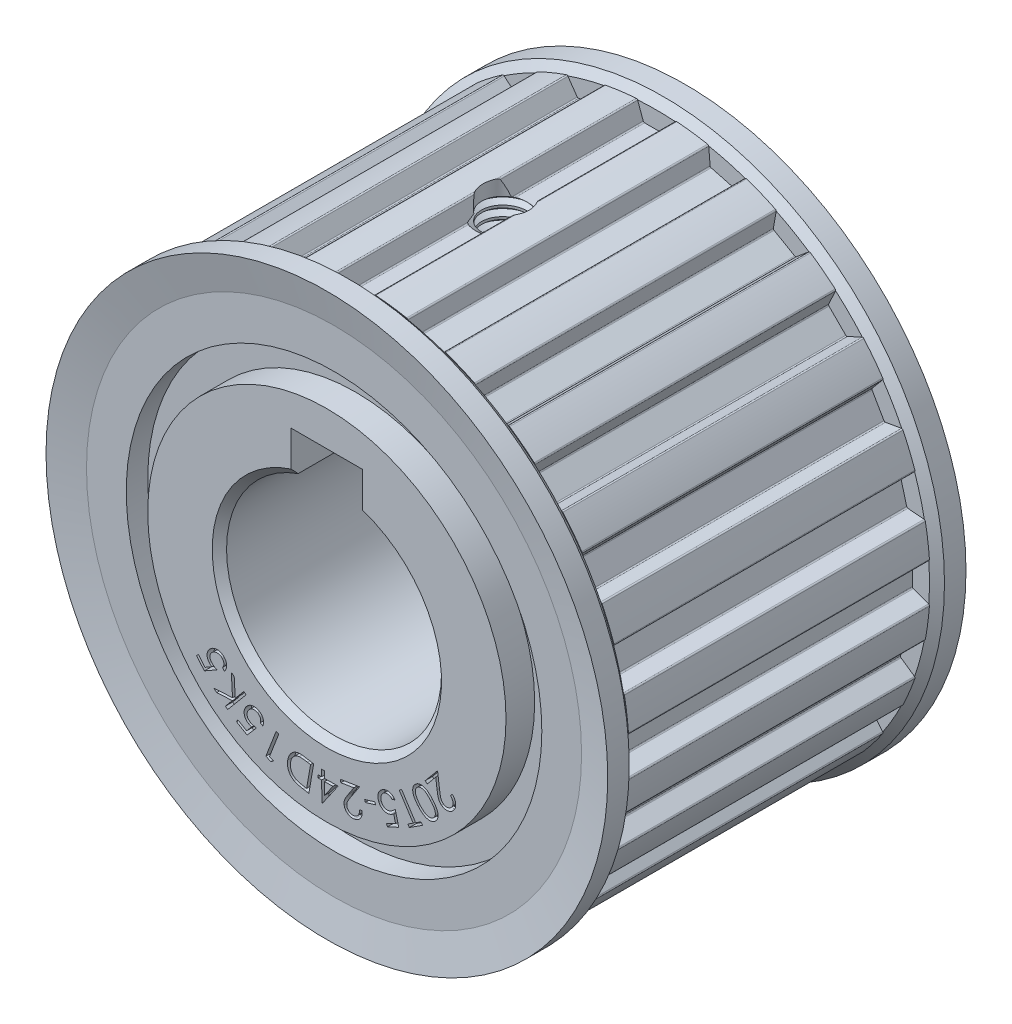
SolidWorks part; units mm, degrees
ref_plane "Front" through (0, 0, 0) normal (0, 0, 1) x (1, 0, 0)
ref_plane "Top" through (0, 0, 0) normal (0, 1, 0) x (1, 0, 0)
ref_plane "Right" through (0, 0, 0) normal (1, 0, 0) x (0, 0, -1)
sketch "Sketch2" plane through (0, 0, 0) normal (1, 0, 0) x (0, 0, -1)
  line L0 (0, 7.5) -> (0, 12.5)
  line L1 (0, 12.5) -> (2, 12.5)
  line L2 (25, 12.5) -> (25, 7.5)
  line L5 (25, 7.5) -> (0, 7.5)
  line L6 (2, 12.5) -> (2, 19.1)
  line L7 (2, 19.1) -> (23, 19.1)
  line L8 (23, 19.1) -> (23, 12.5)
  line L9 (23, 12.5) -> (25, 12.5)
  line L10 (0, 0) -> (27, 0) construction
  dimension "D2" = 19.1
  dimension "D3" = 7.5
  dimension "D4" = 25
  dimension "D6" = 2
  dimension "D7" = 2
  dimension "D8" = 12.5
revolve "Revolve1" add sketch "Sketch2" angle 360 about L10
chamfer "Chamfer1" distance 0.5 angle 45 2 edges at (7.5, 0, 0) (7.5, 0, -25)
sketch "Sketch3" plane through (0, 0, -2) normal (0, 0, 1) x (1, 0, 0)
  line L0 (0, 20.0532) -> (0, 17.8532) construction
  line L1 (0.9, 17.8532) -> (-0.9, 17.8532)
  line L2 (-0.9, 17.8532) -> (-1.3368, 19.0532)
  line L3 (0.9, 17.8532) -> (1.3368, 19.0532)
  line L5 (-1.3368, 19.0532) -> (-1.3368, 20.0532)
  line L6 (-1.3368, 20.0532) -> (1.3368, 20.0532)
  line L7 (1.3368, 20.0532) -> (1.3368, 19.0532)
  circle A0 centre (0, 0) radius 19.1 construction
  point P6 (0, 17.8532)
  dimension "D1" = 2.2
  dimension "D2" = 1.2
  dimension "D3" = 40
  dimension "D4" = 1.8
extrude "Cut-Extrude1" cut sketch "Sketch3" against normal up to next
fillet "Fillet1" radius 0.1 4 edges at (1.3368, 19.0532, -12.5) (0.9, 17.8532, -12.5) (-0.9, 17.8532, -12.5) (-1.3368, 19.0532, -12.5)
pattern_circular "CirPattern2" count 24 over 360 about axis through (0, 0, 0) along (0, 0, 1) of "Fillet1", "Cut-Extrude1"
sketch "Sketch4" plane through (0, 0, 0) normal (1, 0, 0) x (0, 0, -1)
  line L0 (2, 14.5) -> (2, 19.0477)
  line L1 (2, 12.5) -> (2, -12.5) construction
  line L2 (2, 15.9803) -> (2, 17.0945) construction
  line L3 (2, 19.0477) -> (1.5, 19.6)
  line L4 (1.5, 19.6) -> (0, 19.6)
  line L5 (0, 19.6) -> (0.5, 17.2739)
  line L6 (0.5, 17.2739) -> (0.5, 14.5)
  line L7 (0.5, 14.5) -> (2, 14.5)
  line L8 (2, 19.0477) -> (23, 19.0477) construction
  line L9 (0, 0) -> (27, 0) construction
  dimension "D1" = 0
  dimension "D2" = 5.1
  dimension "D3" = 14.5
  dimension "D4" = 0.5
  dimension "D5" = 0.5
revolve "Revolve2" add sketch "Sketch4" angle 360 about L9
ref_plane "Plane1" through (0, 0, -12.5) normal (0, 0, 1) x (1, 0, 0)
mirror "Mirror1" about plane through (0, 0, -12.5) normal (0, 0, 1) of "Revolve2"
sketch "Sketch5" plane through (0, 0, 0) normal (0, 0, 1) x (1, 0, 0)
  arc A0 (-8.3229, -4.5804) -> (8.3543, -4.5228) centre (0, 0) ccw construction
  text T0 "20T5-24D15K5" font "Century Gothic" height 2
extrude "Cut-Extrude2" cut sketch "Sketch5" against normal blind 0.5
ref_plane "Plane2" through (0, 18.9822, 0) normal (0, 1, 0) x (1, 0, 0)
sketch "Sketch6" plane through (0, 18.9822, 0) normal (0, 1, 0) x (1, 0, 0)
  line L0 (-1.3207, 23) -> (1.3207, 23) construction
  circle A0 centre (0, 12.5) radius 1.6
  dimension "D1" = 10.5
extrude "Cut-Extrude3" cut sketch "Sketch6" against normal mid plane 25
thread "Thread1" pitch 0.7 start angle 0, offset 0, length 12, pitch 0.7, diameter 3.2
ref_plane "Plane3" through (1.6, 17.8532, -12.5) normal (0, 0, 1) x (1, 0, 0)
sketch "Thread Profile1" plane through (1.6, 17.8532, -12.5) normal (0, 0, 1) x (1, 0, 0)
  line L0 (0, 0) -> (0, 0.7) construction
  line L1 (0, 0) -> (0.3789, 0.2187)
  line L2 (0.3789, 0.2187) -> (0.3789, 0.3062)
  line L3 (0.3789, 0.3062) -> (0, 0.525)
  line L4 (0.3789, 0.2625) -> (0, 0.2625) construction
  line L11 (0, 0) -> (0, 0.525)
  point P2 (0, 0)
  dimension "Pitch" = 0.7
  dimension "Profile_Angle" = 60
  dimension "Profile_Land" = 0.0875
  dimension "Profile_Height" = 0.3789
sketch "Sketch7" plane through (0, 0, 0) normal (0, 0, 1) x (1, 0, 0)
  line L5 (-2.5, 7.0711) -> (2.5, 7.0711)
  line L6 (-2.5, 7.0711) -> (-2.5, 10.0711)
  line L7 (-2.5, 10.0711) -> (2.5, 10.0711)
  line L8 (2.5, 7.0711) -> (2.5, 10.0711)
  circle A0 centre (0, 0) radius 8 construction
  circle A1 centre (0, 0) radius 7.5 construction
  point P0 (0, 8)
  point P7 (0, 7.0711)
  dimension "D2" = 3
  dimension "D1" = 5
extrude "Cut-Extrude4" cut sketch "Sketch7" against normal up to surface (25 mm away)
